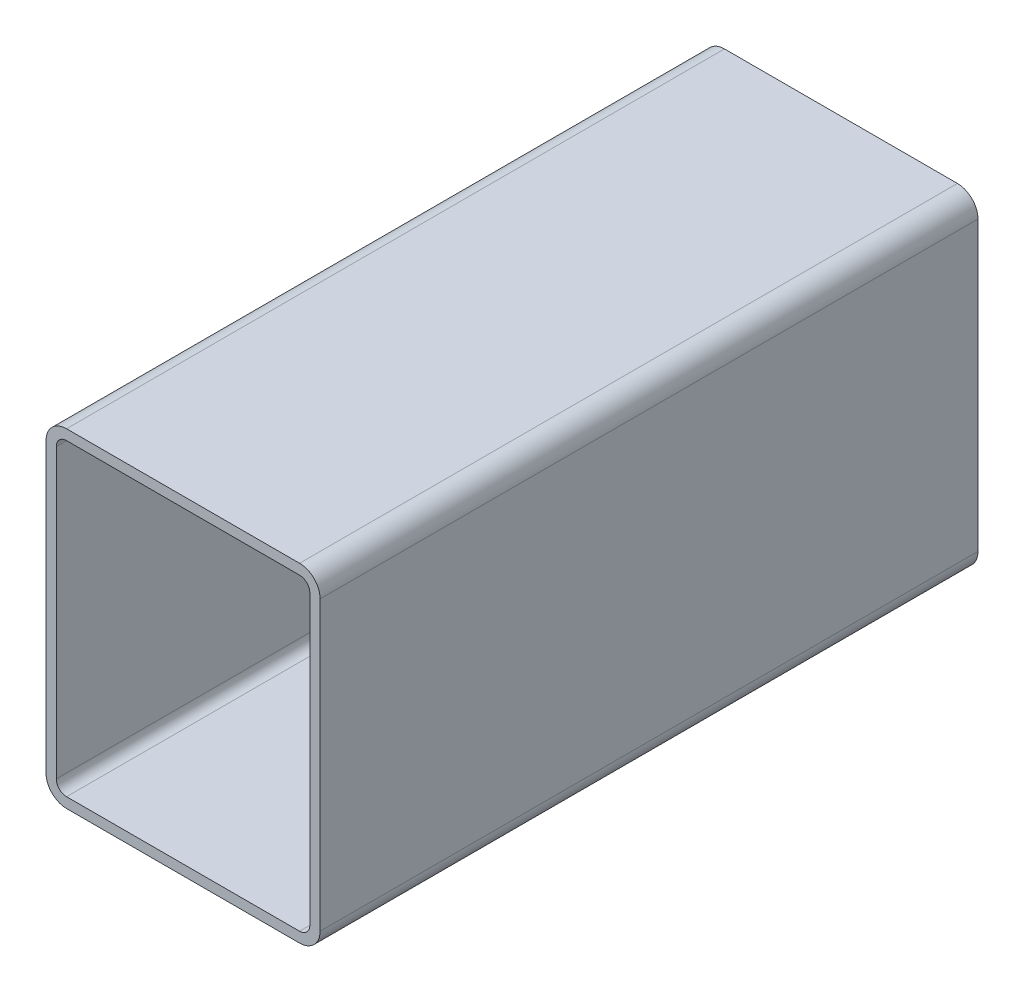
SolidWorks part; units mm, degrees
ref_plane "Front Plane" through (0, 0, 0) normal (0, 0, 1) x (1, 0, 0)
ref_plane "Top Plane" through (0, 0, 0) normal (0, 1, 0) x (1, 0, 0)
ref_plane "Right Plane" through (0, 0, 0) normal (1, 0, 0) x (0, 0, -1)
sketch "Sketch1" plane through (0, 0, 0) normal (0, 0, 1) x (1, 0, 0)
sketch_block_instance "HSS6x5x0.1875-1"
sketch_block "HSS6x5x0.1875"
extrude "Boss-Extrude1" add sketch "Sketch1" along normal blind 304.8
